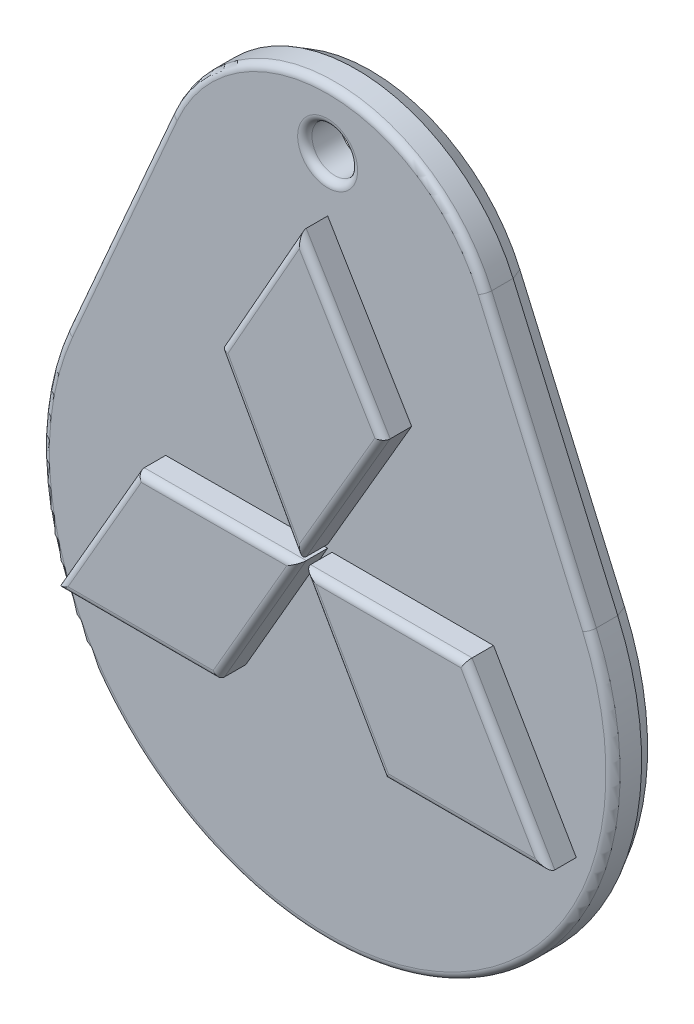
SolidWorks part; units mm, degrees
ref_plane "Front Plane" through (0, 0, 0) normal (0, 0, 1) x (1, 0, 0)
ref_plane "Top Plane" through (0, 0, 0) normal (0, 1, 0) x (1, 0, 0)
ref_plane "Right Plane" through (0, 0, 0) normal (1, 0, 0) x (0, 0, -1)
sketch "Sketch1" plane through (0, 0, 0) normal (0, 0, 1) x (1, 0, 0)
  line L0 (10.9982, 24.8) -> (18.3303, 8)
  line L1 (-10.9982, 24.8) -> (-18.3303, 8)
  arc A0 (-18.3303, 8) -> (18.3303, 8) centre (0, 0) ccw
  arc A1 (10.9982, 24.8) -> (-10.9982, 24.8) centre (0, 20) ccw
  point P12 (-20.4538, -19.375)
  point P15 (20.4538, -19.375)
  dimension "D1" = 20
  dimension "D2" = 24
  dimension "D3" = 20
extrude "Extrude1" add sketch "Sketch1" against normal blind 3
sketch "Sketch2" plane through (0, 0, 0) normal (0, 0, 1) x (1, 0, 0)
  line L0 (0, 4.1601) -> (-5.555, 14.2584)
  line L1 (-5.555, 14.2584) -> (0, 24.088)
  line L2 (0, 24.088) -> (5.8861, 14.2584)
  line L3 (5.8861, 14.2584) -> (0, 4.1601)
extrude "Extrude2" add sketch "Sketch2" along normal blind 2
sketch "Sketch3" plane through (0, 0, 0) normal (0, 0, 1) x (1, 0, 0)
  line L0 (0, 3.9258) -> (-5.7317, -6.0062)
  line L1 (-5.7317, -6.0062) -> (-17.0564, -6.0062)
  line L2 (-17.0564, -6.0062) -> (-11.349, 3.8837)
  line L3 (-11.349, 3.8837) -> (0, 3.9258)
extrude "Extrude3" add sketch "Sketch3" along normal blind 2
sketch "Sketch4" plane through (0, 0, 0) normal (0, 0, 1) x (1, 0, 0)
  line L0 (0.3058, 3.8318) -> (11.6222, 3.8318)
  line L1 (11.6222, 3.8318) -> (17.4214, -6.1366)
  line L2 (17.4214, -6.1366) -> (5.964, -6.1366)
  line L3 (5.964, -6.1366) -> (0.3058, 3.8318)
extrude "Extrude4" add sketch "Sketch4" along normal blind 2
fillet "Fillet1" radius 0.5 12 edges at (2.9431, 9.2093, 2) (2.9431, 19.1732, 2) (-2.7775, 19.1732, 2) (-2.7775, 9.2093, 2) (-11.394, -6.0062, 2) (-2.8658, -1.0402, 2) (-5.6745, 3.9048, 2) (-14.2027, -1.0612, 2) (3.1349, -1.1524, 2) (11.6927, -6.1366, 2) (14.5218, -1.1524, 2) (5.964, 3.8318, 2)
sketch "Sketch6" plane through (0, 0, 0) normal (0, 0, 1) x (1, 0, 0)
  circle A0 centre (0, 27.8901) radius 1.6
extrude "Cut-Extrude1" cut sketch "Sketch6" against normal through all
fillet "Fillet2" radius 0.5 5 edges at (-14.6642, 16.4, 0) (0, 32, 0) (14.6642, 16.4, 0) (0, -20, 0) (1.6, 27.8901, 0)
chamfer "Chamfer1" distance 1 angle 30 5 edges at (0, 32, -3) (-14.6642, 16.4, -3) (0, -20, -3) (14.6642, 16.4, -3) (1.6, 27.8901, -3)
